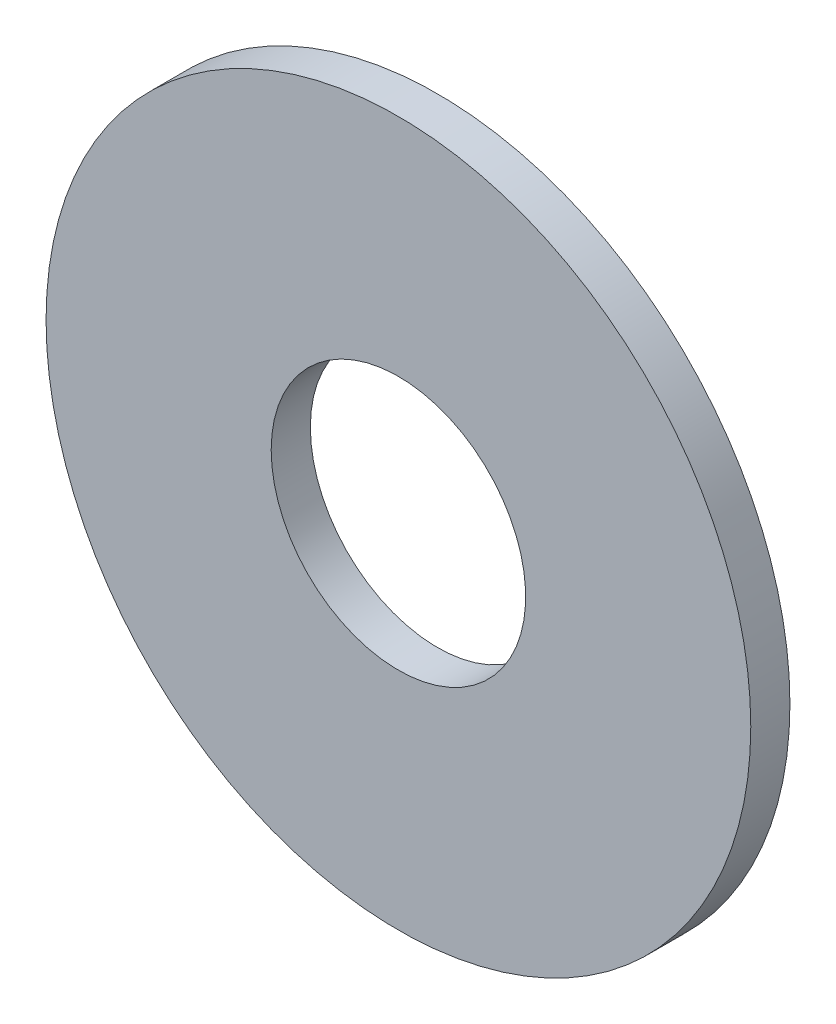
SolidWorks part; units mm, degrees
ref_plane "Плоскость1" through (0, 0, 0) normal (0, 0, 1) x (1, 0, 0)
ref_plane "Плоскость2" through (0, 0, 0) normal (0, 1, 0) x (1, 0, 0)
ref_plane "Плоскость3" through (0, 0, 0) normal (1, 0, 0) x (0, 0, -1)
sketch "Эскиз1" plane through (0, 0, 0) normal (0, 0, 1) x (1, 0, 0)
  circle A0 centre (-10, -20) radius 3.25
  circle A1 centre (-10, -20) radius 9
  dimension "D1" = 6.5
  dimension "D2" = 18
extrude "Основание-Вытянуть" add sketch "Эскиз1" along normal blind 1
